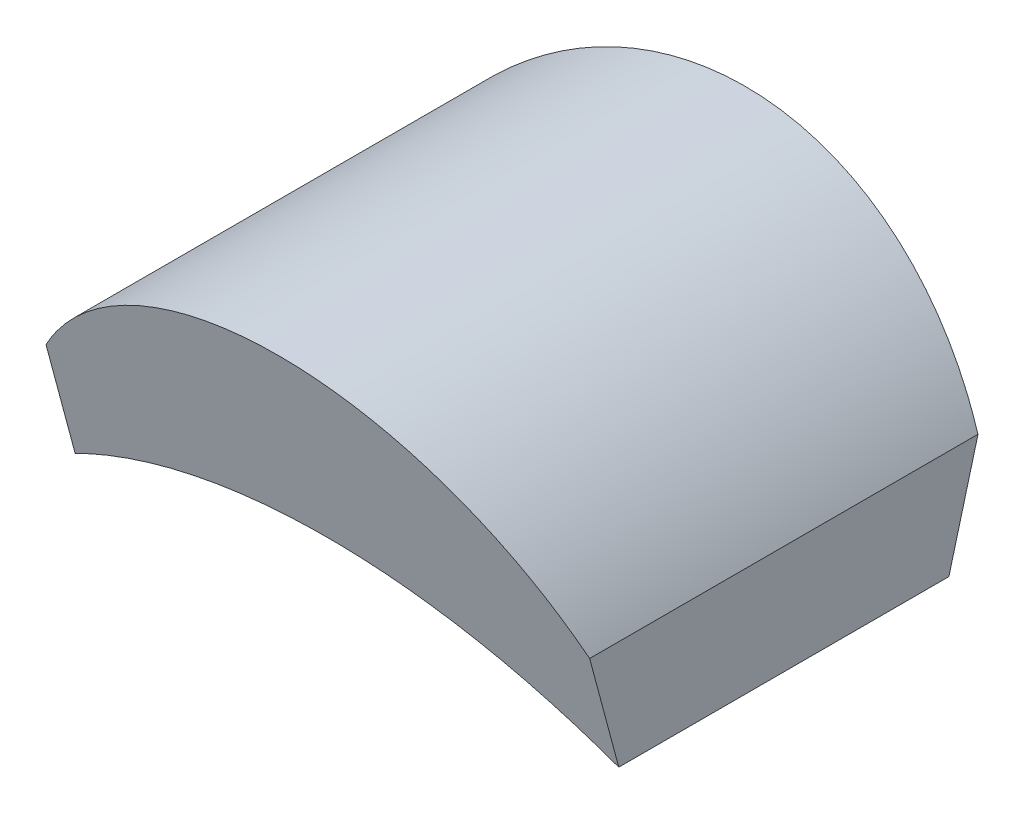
SolidWorks part; units mm, degrees
ref_plane "Płaszczyzna przednia" through (0, 0, 0) normal (0, 0, 1) x (1, 0, 0)
ref_plane "Płaszczyzna górna" through (0, 0, 0) normal (0, 1, 0) x (1, 0, 0)
ref_plane "Płaszczyzna prawa" through (0, 0, 0) normal (1, 0, 0) x (0, 0, -1)
body saved out of another part "Zapas-Przykład-1"
